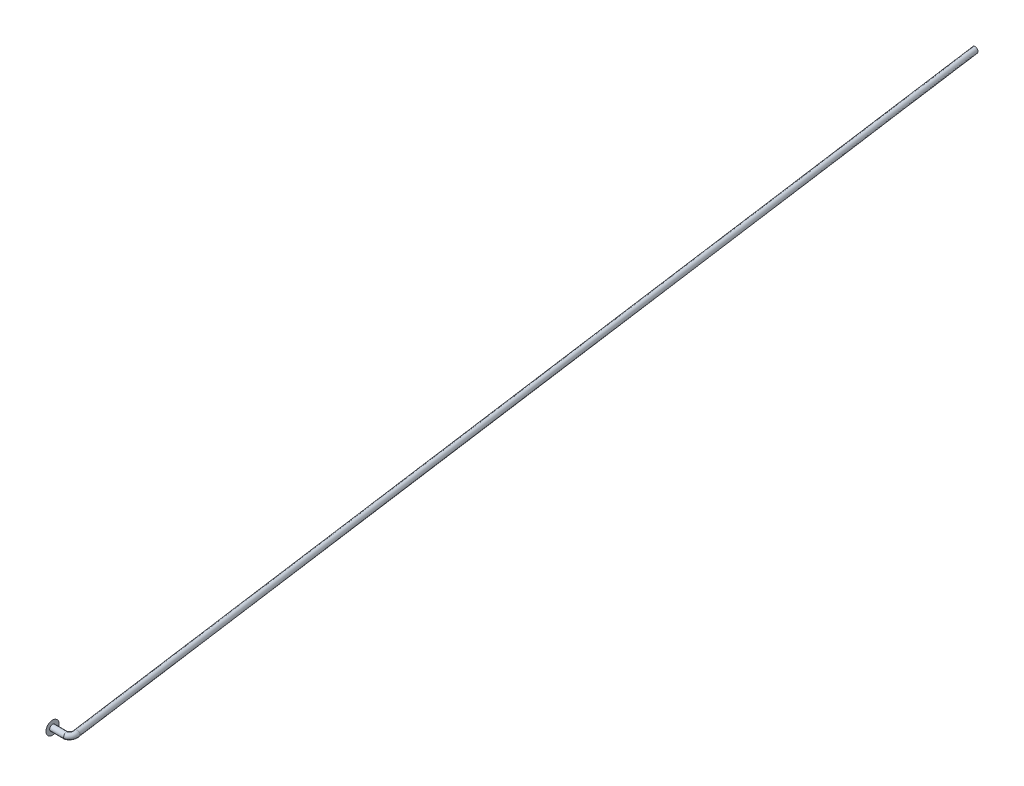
SolidWorks part; units mm, degrees
ref_plane "Front Plane" through (0, 0, 0) normal (0, 0, 1) x (1, 0, 0)
ref_plane "Top Plane" through (0, 0, 0) normal (0, 1, 0) x (1, 0, 0)
ref_plane "Right Plane" through (0, 0, 0) normal (1, 0, 0) x (0, 0, -1)
ref_plane "Plane1" through (0, 0, 7) normal (0, 0, 1) x (1, 0, 0)
sketch "spita" plane through (0, 0, 0) normal (0, 1, 0) x (1, 0, 0)
  line L3 (-28.5926, -277.4501) -> (-65.6515, -7)
  line L9 (-33, -279.3291) -> (-29.5, -279.3291)
  arc A0 (-28.5926, -277.4501) -> (-29.5, -279.3291) centre (-30.0168, -277.9209) cw
  dimension "D1" = 1.5
  dimension "D2" = 3.5
  dimension "D3" = 7
sketch "Sketch2" plane through (0, 0, 7) normal (0, 0, 1) x (1, 0, 0)
  circle A0 centre (-65.6523, -0.004) radius 0.75
  circle A1 centre (-65.6523, -0.004) radius 1.5 construction
  dimension "D1" = 1.5
  dimension "D2" = 3
sweep "Sweep1" add profiles "Sketch2" path "spita"
sketch "Sketch3" plane through (0, 0, 0) normal (0, 1, 0) x (1, 0, 0)
  line L0 (-33.6, -279.3291) -> (-33, -279.3291)
  line L1 (-33, -279.3291) -> (-33, -277.6291)
  arc A0 (-33, -277.6291) -> (-33.6, -279.3291) centre (-30.6017, -279.4314) ccw
  dimension "D1" = 3
  dimension "D2" = 0.6
  dimension "D3" = 1.7
revolve "Revolve1" add sketch "Sketch3" angle 360 about L0
sketch "Sketch5" plane through (0, 0, 7) normal (0, 0, -1) x (-1, 0, 0)
  circle A1 centre (65.6523, -0.004) radius 0.75
  circle A2 centre (65.6523, -0.004) radius 0.75
  dimension "D1" = 0
